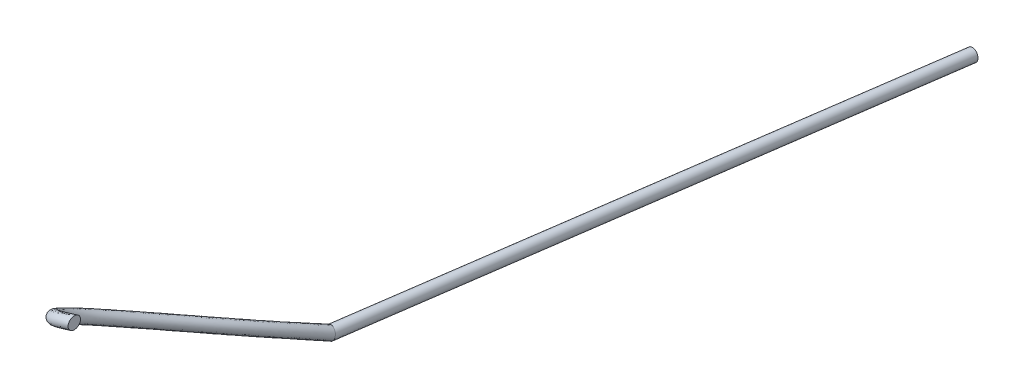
SolidWorks part; units mm, degrees
ref_plane "Plan de face" through (0, 0, 0) normal (0, 0, 1) x (1, 0, 0)
ref_plane "Plan de dessus" through (0, 0, 0) normal (0, 1, 0) x (1, 0, 0)
ref_plane "Plan de droite" through (0, 0, 0) normal (1, 0, 0) x (0, 0, -1)
sketch3d "Esquisse3D1"
  line L0 (15.2144, -306.3577, -162.7148) -> (15.2144, -306.3577, -192.7148) construction
  line L1 (15.2144, -306.3577, -192.7148) -> (15.2144, -306.3577, -201.7148) construction
  line L2 (15.2144, -306.3577, -156.7148) -> (15.2144, -306.3577, -162.7148) construction
  circle A0 centre (-17.0125, -267.6768, 104.5806) radius 2 construction
  circle A1 centre (-3.1616, -298.4633, 34.7852) radius 2 construction
  spline S0 degree 3 poles (-17.0125, -267.6768, 104.5806) (-18.1642, -267.967, 104.6865) (-35.938, -272.4448, 106.3202) (-11.3157, -286.9212, 62.7136) (-5.3466, -295.3704, 42.269) (-3.1616, -298.4633, 34.7852) knots 0 0 0 0 0.042077 0.649352 1 1 1 1
  spline S1 degree 3 poles (-3.1616, -298.4633, 34.7852) (2.9638, -301.0948, -29.0481) (9.0891, -303.7263, -92.8815) (15.2144, -306.3577, -156.7148) knots 0 0 0 0 1 1 1 1
  point P8 (-3.1616, -298.4633, 36.7852)
  point P12 (-19.0122, -267.6594, 104.5504)
sketch "Esquisse1" plane through (-13.0915, 0.1143, -0.1979) normal (-0.9998, 0.0087, -0.0151) x (-0.0151, 0.0001, 0.9999)
  circle A0 centre (104.7905, -267.8151) radius 2
sweep "Balayage1" add profiles "Esquisse1" path "Esquisse3D1"
